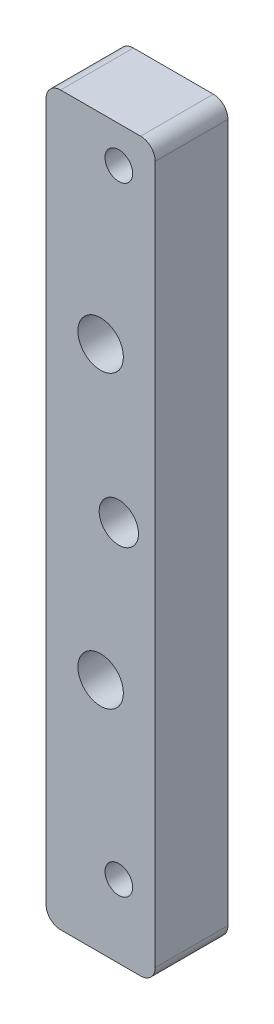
SolidWorks part; units mm, degrees
ref_plane "Front Plane" through (0, 0, 0) normal (0, 0, 1) x (1, 0, 0)
ref_plane "Top Plane" through (0, 0, 0) normal (0, 1, 0) x (1, 0, 0)
ref_plane "Right Plane" through (0, 0, 0) normal (1, 0, 0) x (0, 0, -1)
sketch "Sketch1" plane through (0, 0, 0) normal (0, 0, 1) x (1, 0, 0)
  line L1 (-7.6893, 54.7924) -> (11.3607, 54.7924)
  line L2 (-7.6893, 54.7924) -> (-7.6893, -72.2076)
  line L3 (-7.6893, -72.2076) -> (11.3607, -72.2076)
  line L4 (11.3607, 54.7924) -> (11.3607, -72.2076)
  dimension "D1" = 127
  dimension "D2" = 19.05
extrude "Boss-Extrude1" add sketch "Sketch1" along normal blind 12.7
sketch "Sketch2" plane through (0, 0, 12.7) normal (0, 0, 1) x (1, 0, 0)
  line L0 (11.3607, -72.2076) -> (11.3607, 54.7924) construction
  line L1 (5.0107, 54.7924) -> (5.0107, -72.2076) construction
  line L2 (11.3607, 54.7924) -> (-7.6893, 54.7924) construction
  line L3 (-7.6893, -72.2076) -> (11.3607, -72.2076) construction
  line L4 (-7.6893, -8.7076) -> (11.3607, -8.7076) construction
  line L5 (-7.6893, 54.7924) -> (-7.6893, -72.2076) construction
  circle A0 centre (5.0107, 48.4424) radius 2.413
  circle A1 centre (5.0107, -59.5076) radius 2.413
  circle A2 centre (5.0107, -5.5326) radius 3.429
  dimension "D5" = 4.826
  dimension "D6" = 6.858
  dimension "D7" = 4.826
  dimension "D1" = 6.35
  dimension "D2" = 6.35
  dimension "D3" = 12.7
  dimension "D4" = 3.175
extrude "Cut-Extrude1" cut sketch "Sketch2" against normal through all
sketch "Sketch3" plane through (0, 0, 12.7) normal (0, 0, 1) x (1, 0, 0)
  line L0 (11.3607, -72.2076) -> (11.3607, 54.7924) construction
  circle A0 centre (1.8357, 19.8674) radius 3.9688
  circle A1 centre (1.8357, -30.9326) radius 3.9688
  circle A2 centre (5.0107, -5.5326) radius 3.429 construction
  dimension "D1" = 25.4
  dimension "D2" = 25.4
  dimension "D4" = 7.9375
  dimension "D5" = 7.9375
  dimension "D3" = 9.525
extrude "Cut-Extrude2" cut sketch "Sketch3" against normal through all
fillet "Fillet1" radius 2.54 4 edges at (11.3607, -72.2076, 6.35) (-7.6893, -72.2076, 6.35) (11.3607, 54.7924, 6.35) (-7.6893, 54.7924, 6.35)
